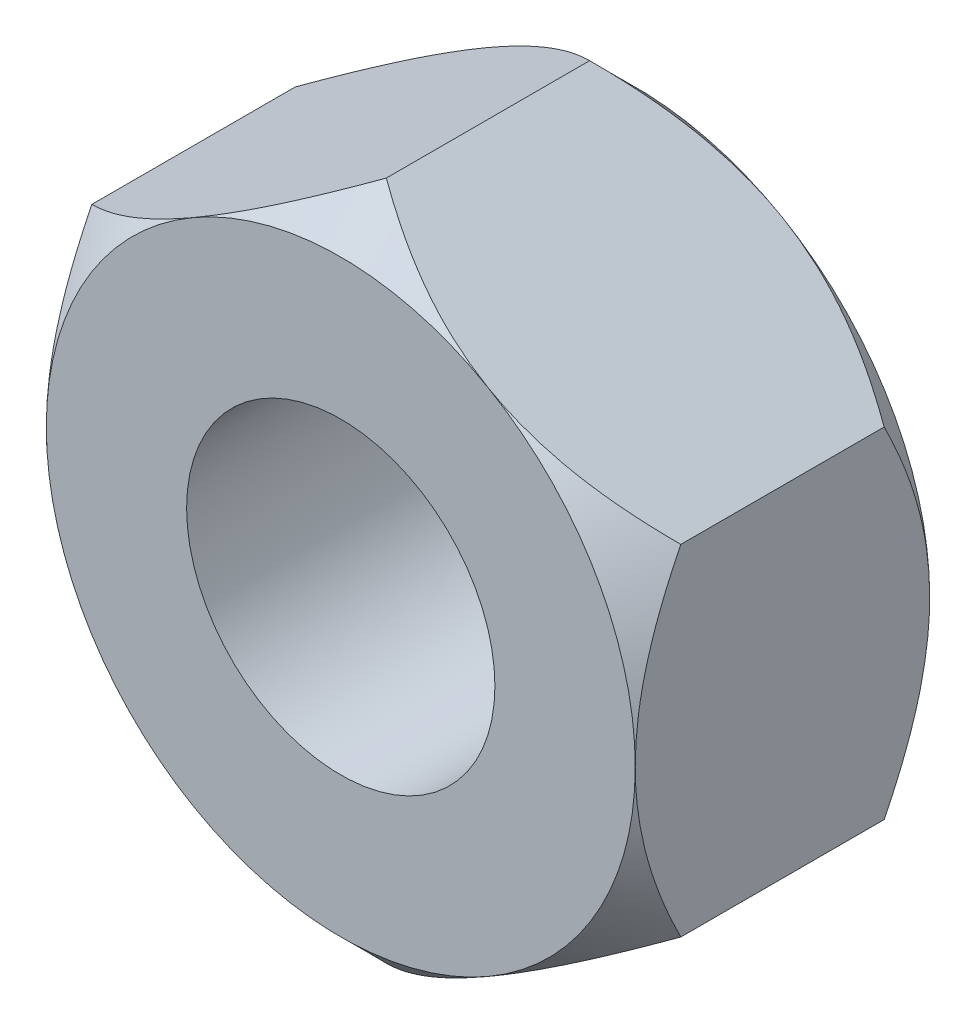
SolidWorks part; units mm, degrees
ref_plane "Front" through (0, 0, 0) normal (0, 0, 1) x (1, 0, 0)
ref_plane "Top" through (0, 0, 0) normal (0, 1, 0) x (1, 0, 0)
ref_plane "Right" through (0, 0, 0) normal (1, 0, 0) x (0, 0, -1)
sketch "Sketch1" plane through (0, 0, 0) normal (0, 0, 1) x (1, 0, 0)
  line L0 (0, 0) -> (0, 9.2376) construction
  line L1 (0, 0) -> (-8, 0) construction
  line L2 (8, 4.6188) -> (8, -4.6188)
  line L3 (8, 4.6188) -> (0, 9.2376)
  line L4 (-8, 4.6188) -> (0, 9.2376)
  line L5 (-8, 4.6188) -> (-8, -4.6188)
  line L6 (-8, -4.6188) -> (0, -9.2376)
  line L7 (8, -4.6188) -> (0, -9.2376)
  point P12 (8, 0)
  dimension "D1" = 60
extrude "Base-Extrude" add sketch "Sketch1" along normal mid plane 8
sketch "Sketch3" plane through (0, 0, 0) normal (0, 1, 0) x (1, 0, 0)
  line L1 (-8, 4) -> (0, 4) construction
  line L2 (-8, -4) -> (-8, 4) construction
  line L3 (-13, 4) -> (-8, 4)
  line L4 (-8, 4) -> (-13, -1)
  line L5 (-13, -1) -> (-13, 4)
  line L6 (0, 4) -> (0, -3.8824) construction
  dimension "D1" = 5
  dimension "D2" = 45
revolve "Cut-Revolve1" cut sketch "Sketch3" angle 360 about L6
mirror "Mirror1" about plane through (0, 0, 0) normal (0, 0, 1) of "Cut-Revolve1"
sketch "Sketch4" plane through (0, 0, 4) normal (0, 0, 1) x (1, 0, 0)
  circle A0 centre (0, 0) radius 4.188
  dimension "d" = 8.376
extrude "Cut-Extrude1" cut sketch "Sketch4" against normal through all
